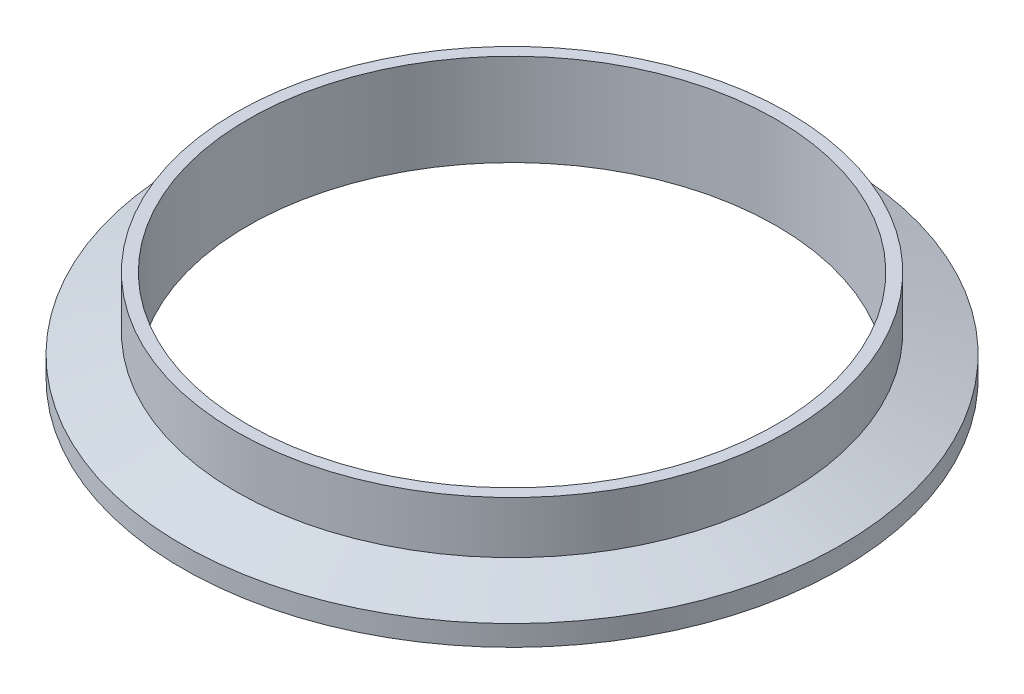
SolidWorks part; units mm, degrees
ref_plane "Front Plane" through (0, 0, 0) normal (0, 0, 1) x (1, 0, 0)
ref_plane "Top Plane" through (0, 0, 0) normal (0, 1, 0) x (1, 0, 0)
ref_plane "Right Plane" through (0, 0, 0) normal (1, 0, 0) x (0, 0, -1)
sketch "Sketch1" plane through (0, 0, 0) normal (0, 0, 1) x (1, 0, 0)
  line L0 (0, 0) -> (0, 12.7) construction
  line L1 (0, 12.7) -> (-38.1, 12.7)
  line L2 (-38.1, 12.7) -> (-38.1, 5.5212)
  line L3 (-38.1, 5.5212) -> (-45.4533, 2.8448)
  line L4 (-45.4533, 2.8448) -> (-45.4533, 0)
  line L5 (-45.4533, 0) -> (-43.4867, 0)
  line L6 (-39.8507, 0) -> (0, 0)
  line L7 (0, 0) -> (0, 12.7)
  line L8 (0, 12.7) -> (-36.449, 12.7)
  line L9 (-36.449, 12.7) -> (-36.449, 0)
  line L10 (-36.449, 0) -> (0, 0)
  line L11 (0, 0) -> (-0.1846, 0.0129)
  arc A0 (-42.7642, 0.4745) -> (-40.5732, 0.4745) centre (-41.6687, 0) cw
  arc A1 (-39.8507, 0) -> (-40.5732, 0.4745) centre (-39.8507, 0.7874) cw
  arc A2 (-42.7642, 0.4745) -> (-43.4867, 0) centre (-43.4867, 0.7874) cw
  point P12 (-40.4749, 0)
  dimension "D6" = 1.1938
  dimension "D7" = 0.7874
  dimension "D1" = 38.1
  dimension "D2" = 2.8448
  dimension "D3" = 45.4533
  dimension "D4" = 70
  dimension "D5" = 41.6687
  dimension "D8" = 36.449
  dimension "D9" = 12.7
revolve "Revolve2" add sketch "Sketch1" angle 360 about L0
